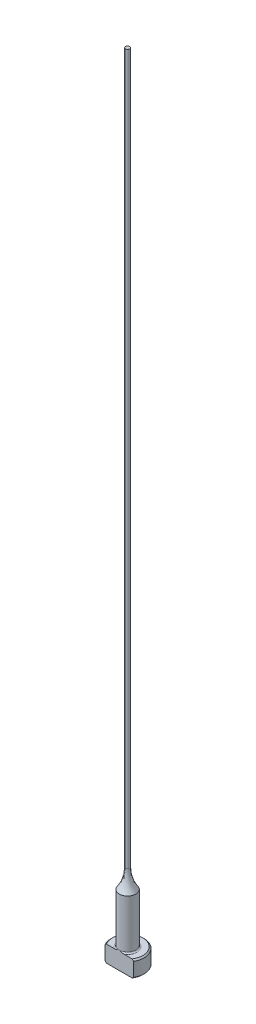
SolidWorks part; units mm, degrees
ref_plane "Front Plane" through (0, 0, 0) normal (0, 0, 1) x (1, 0, 0)
ref_plane "Top Plane" through (0, 0, 0) normal (0, 1, 0) x (1, 0, 0)
ref_plane "Right Plane" through (0, 0, 0) normal (1, 0, 0) x (0, 0, -1)
sketch "Sketch1" plane through (0, 0, 0) normal (0, 0, 1) x (1, 0, 0)
  line L0 (0, 259.9588) -> (0, -15.1925) construction
  line L1 (0, 0) -> (-3.175, 0)
  line L2 (-3.175, 0) -> (-3.175, 3.175)
  line L3 (-3.175, 3.175) -> (-1.5875, 3.175)
  line L4 (-0.3962, 16.4027) -> (-0.3962, 152.4)
  line L5 (-0.3962, 152.4) -> (0, 152.4)
  line L6 (0, 152.4) -> (0, 0)
  line L7 (-1.5875, 3.175) -> (-1.5875, 12.7)
  arc A0 (-1.5875, 12.7) -> (-0.3962, 16.4027) centre (-6.7462, 16.4027) ccw
  point P13 (-1.5875, 0)
  dimension "D1" = 6.35
  dimension "L" = 152.4
  dimension "D2" = 3.175
  dimension "H" = 6.35
  dimension "T" = 3.175
  dimension "D" = 0.7925
  dimension "S" = 12.7
revolve "Revolve1" add sketch "Sketch1" angle 360 about L0
chamfer "Chamfer1" distance 0.254 angle 45 2 edges at (0, 3.175, 3.175) (0, 0, 3.175)
fillet "Fillet1" radius 0.254 1 edges at (0, 3.175, 1.5875)
sketch "Sketch2" plane through (0, 0, 0) normal (0, -1, 0) x (1, 0, 0)
  line L0 (-2.7496, 1.5875) -> (2.7496, 1.5875)
  circle A0 centre (0, 0) radius 3.175 construction
  arc A1 (2.7496, 1.5875) -> (-2.7496, 1.5875) centre (0, 0) ccw
  circle A4 centre (0, 0) radius 1.5875 construction
  dimension "D1" = 0
extrude "KEY" cut sketch "Sketch2" against normal through all
